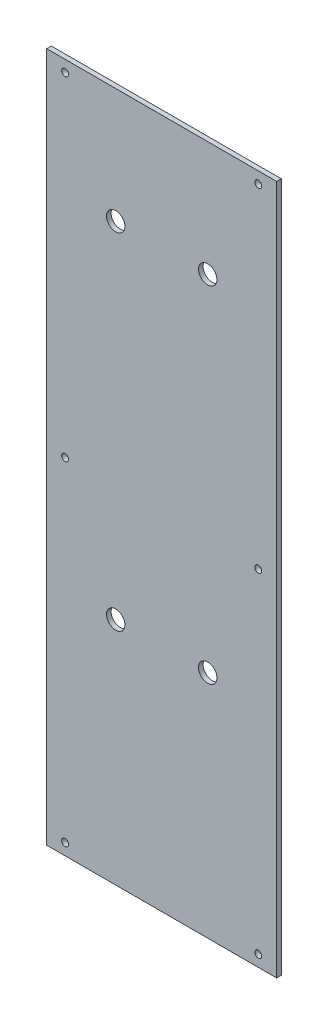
SolidWorks part; units mm, degrees
ref_plane "Plan de face" through (0, 0, 0) normal (0, 0, 1) x (1, 0, 0)
ref_plane "Plan de dessus" through (0, 0, 0) normal (0, 1, 0) x (1, 0, 0)
ref_plane "Plan de droite" through (0, 0, 0) normal (1, 0, 0) x (0, 0, -1)
sketch "Esquisse1" plane through (0, 0, 0) normal (0, 0, 1) x (1, 0, 0)
  line L1 (0, 0) -> (100, 0)
  line L2 (0, 0) -> (0, 300)
  line L3 (0, 300) -> (100, 300)
  line L4 (100, 0) -> (100, 300)
  dimension "D1" = 100
  dimension "D2" = 300
extrude "Extrusion1" add sketch "Esquisse1" along normal blind 2
sketch "Esquisse3" plane through (0, 0, 2) normal (0, 0, 1) x (1, 0, 0)
  line L0 (0, 300) -> (0, 0) construction
  line L1 (100, 300) -> (0, 300) construction
  circle A0 centre (30, 250) radius 4
  dimension "D3" = 8
  dimension "D1" = 30
  dimension "D2" = 50
extrude "Enlèv. mat.-Extru.1" cut sketch "Esquisse3" against normal through all
pattern_linear "Répétition linéaire1" count 2 spacing 40 along (1, 0, 0) count 2 spacing 150 along (0, -1, 0) of "Enlèv. mat.-Extru.1"
sketch "Esquisse4" plane through (0, 0, 2) normal (0, 0, 1) x (1, 0, 0)
  line L0 (0, 300) -> (0, 0) construction
  line L1 (100, 300) -> (0, 300) construction
  circle A0 centre (8, 295) radius 1.5
  dimension "D3" = 3
  dimension "D1" = 8
  dimension "D2" = 5
extrude "Enlèv. mat.-Extru.2" cut sketch "Esquisse4" against normal through all
pattern_linear "Répétition linéaire2" count 2 spacing 84 along (1, 0, 0) count 3 spacing 145 along (0, -1, 0) of "Enlèv. mat.-Extru.2"
